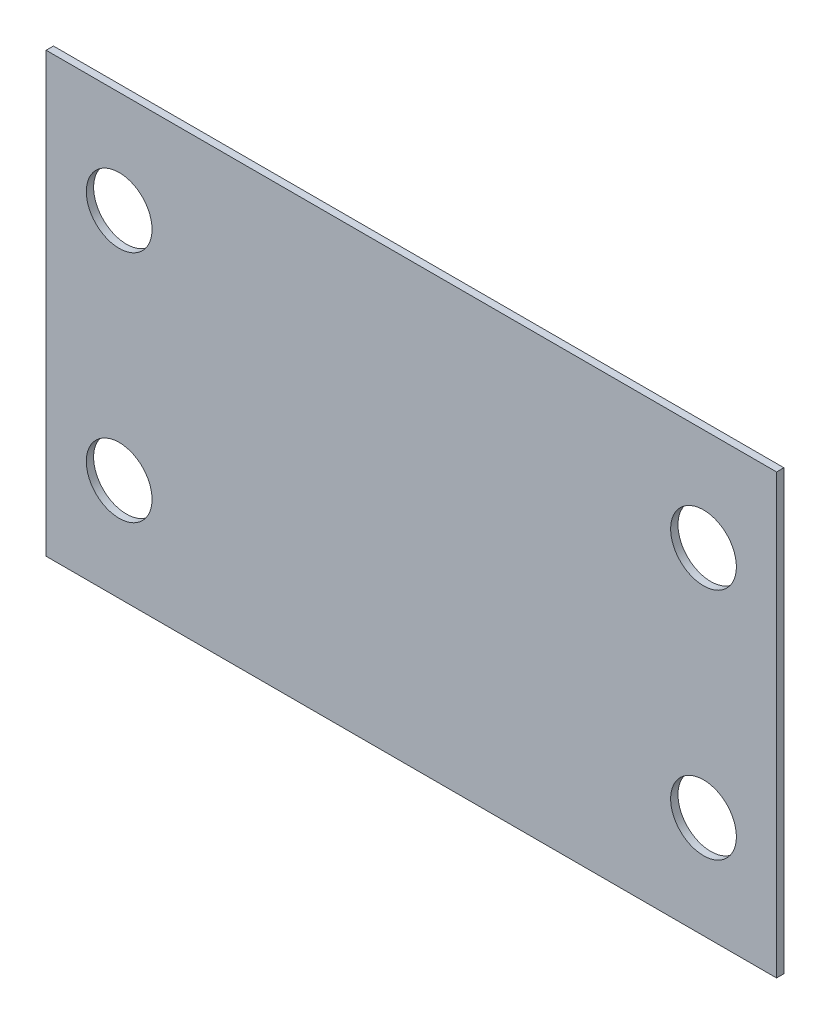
SolidWorks part; units mm, degrees
ref_plane "Face" through (0, 0, 0) normal (0, 0, 1) x (1, 0, 0)
ref_plane "Dessus" through (0, 0, 0) normal (0, 1, 0) x (1, 0, 0)
ref_plane "Droite" through (0, 0, 0) normal (1, 0, 0) x (0, 0, -1)
ref_plane "Plan1" through (0, 0, 0) normal (0, 0, 1) x (1, 0, 0)
sketch "Esquisse1" plane through (0, 0, 0) normal (0, 0, 1) x (1, 0, 0)
  line L0 (-25, 15) -> (-25, -15)
  line L1 (-25, -15) -> (25, -15)
  line L2 (25, -15) -> (25, 15)
  line L3 (25, 15) -> (-25, 15)
  circle A0 centre (20, -8) radius 2.25
  circle A1 centre (20, 8) radius 2.25
  circle A2 centre (-20, -8) radius 2.25
  circle A3 centre (-20, 8) radius 2.25
extrude "Boss.-Extru.1" add sketch "Esquisse1" along normal blind 0.5
